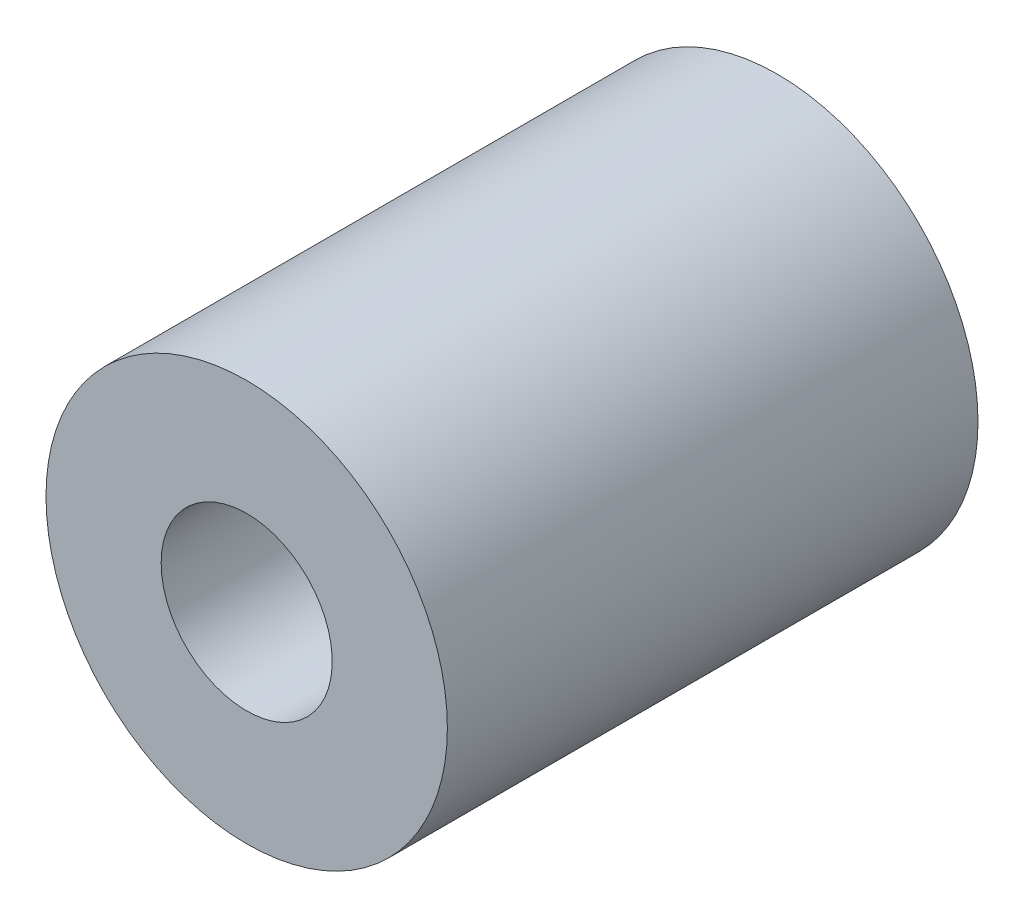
SolidWorks part; units mm, degrees
ref_plane "Front Plane" through (0, 0, 0) normal (0, 0, 1) x (1, 0, 0)
ref_plane "Top Plane" through (0, 0, 0) normal (0, 1, 0) x (1, 0, 0)
ref_plane "Right Plane" through (0, 0, 0) normal (1, 0, 0) x (0, 0, -1)
sketch "Sketch2" plane through (0, 0, 0) normal (0, 0, 1) x (1, 0, 0)
  circle A0 centre (0, 0) radius 4
  circle A1 centre (0, 0) radius 9.3853
  point P5 (0, 0.3763)
  dimension "D1" = 8
  dimension "D2" = 18.7706
extrude "Boss-Extrude1" add sketch "Sketch2" along normal blind 24.8158
